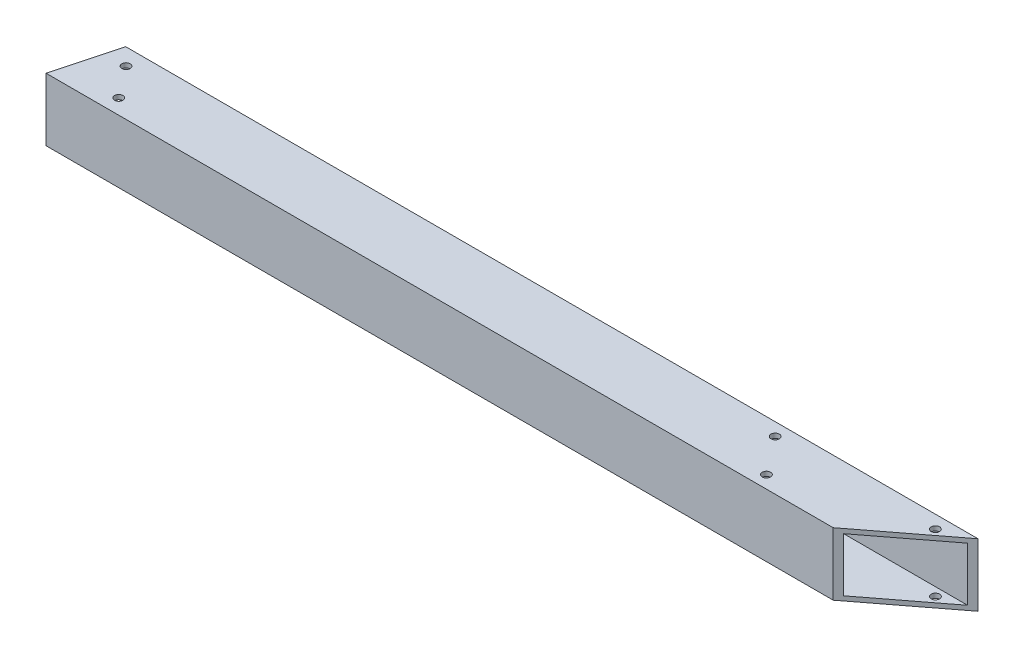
SolidWorks part; units mm, degrees
ref_plane "Front" through (0, 0, 0) normal (0, 0, 1) x (1, 0, 0)
ref_plane "Top" through (0, 0, 0) normal (0, 1, 0) x (1, 0, 0)
ref_plane "Right" through (0, 0, 0) normal (1, 0, 0) x (0, 0, -1)
sketch "Sketch1" plane through (0, 0, 0) normal (1, 0, 0) x (0, 0, -1)
  line L1 (0, 0) -> (50.8, 0)
  line L2 (0, 0) -> (0, 50.8)
  line L3 (0, 50.8) -> (50.8, 50.8)
  line L4 (50.8, 0) -> (50.8, 50.8)
  line L5 (3.6576, 47.1424) -> (47.1424, 47.1424)
  line L6 (3.6576, 47.1424) -> (3.6576, 3.6576)
  line L7 (3.6576, 3.6576) -> (47.1424, 3.6576)
  line L8 (47.1424, 47.1424) -> (47.1424, 3.6576)
  dimension "D1" = 50.8
  dimension "D2" = 50.8
  dimension "D3" = 3.6576
  dimension "D4" = 3.6576
  dimension "D5" = 3.6576
  dimension "D6" = 3.6576
extrude "Extrude1" add sketch "Sketch1" along normal blind 3048
sketch "Sketch3" plane through (0, 0, -50.8) normal (0, 0, -1) x (-1, 0, 0)
  line L5 (0, 0) -> (0, -664.0913) construction
  line L6 (0, -664.0913) -> (-3047.8384, -664.0913) construction
  line L7 (-3047.8384, 0) -> (-3047.8384, -664.0913) construction
  line L8 (-1523.9192, -664.0913) -> (-1523.9192, 171.6838) construction
  circle A0 centre (-95.6188, 12.3324) radius 3.3731
  circle A1 centre (-57.6849, 37.9799) radius 3.3731
  circle A2 centre (-3028.95, 12.7) radius 3.3731
  circle A4 centre (-19.4204, 12.8284) radius 3.3731
  circle A5 centre (-2952.2196, 12.3324) radius 3.3731
  circle A6 centre (-2990.85, 38.1) radius 3.3731
  point P0 (-3047.8384, 0)
extrude "Cut-Extrude2" [suppressed] cut sketch "Sketch3" against normal through all
sketch "Sketch4" plane through (0, 0, -50.8) normal (0, 0, -1) x (-1, 0, 0)
  circle A0 centre (-2235.1466, 25.4) radius 3.3731
  circle A1 centre (-2298.6466, 25.4) radius 3.3731
  circle A2 centre (-2362.1466, 25.4) radius 3.3731
  circle A3 centre (-812.7466, 25.4) radius 3.3731
  circle A4 centre (-749.2466, 25.4) radius 3.3731
  circle A5 centre (-685.7466, 25.4) radius 3.3731
  dimension "D1" = 6.7462
extrude "Cut-Extrude3" [suppressed] cut sketch "Sketch4" against normal through all
sketch "Sketch5" plane through (0, 0, -50.8) normal (0, 0, -1) x (-1, 0, 0)
  circle A0 centre (-1536.7, 38.1) radius 3.3731
  circle A1 centre (-1511.2466, 12.7) radius 3.3731
  dimension "D1" = 6.7462
sketch "Sketch6" plane through (0, 0, -50.8) normal (0, 0, -1) x (-1, 0, 0)
  circle A0 centre (-1524.0534, 25.4) radius 3.3731
  circle A1 centre (-1460.5534, 25.4) radius 3.3731
  circle A2 centre (-1587.5534, 25.4) radius 3.3731
  circle A3 centre (-736.6534, 12.7) radius 3.3731
  circle A4 centre (-762.0534, 38.1) radius 3.3731
  circle A5 centre (-2311.4534, 38.1) radius 3.3731
  circle A6 centre (-2286.0534, 12.7) radius 3.3731
  dimension "D1" = 6.7462
  dimension "D2" = 6.7462
  dimension "D3" = 6.7462
extrude "Cut-Extrude4" [suppressed] cut sketch "Sketch6" against normal through all
sketch "Sketch7" plane through (0, 0, -50.8) normal (0, 0, -1) x (-1, 0, 0)
  circle A0 centre (-1536.7, 38.1) radius 3.3731
  circle A1 centre (-1511.2466, 12.7) radius 3.3731
  dimension "D1" = 6.7462
  dimension "D2" = 6.7462
extrude "Cut-Extrude5" [suppressed] cut sketch "Sketch7" against normal through all
sketch "Sketch8" plane through (0, 0, 0) normal (0, 0, 1) x (1, 0, 0)
  line L0 (1524, 50.8) -> (1524, 207.5111) construction
  line L1 (3048, 50.8) -> (0, 50.8) construction
  circle A0 centre (95.25, 12.7) radius 3.304
  circle A1 centre (57.15, 38.1) radius 3.1902
  circle A2 centre (19.05, 12.7) radius 3.304
  circle A3 centre (3028.95, 12.7) radius 3.304
  circle A4 centre (2990.85, 38.1) radius 3.1902
  circle A5 centre (2952.75, 12.7) radius 3.304
extrude "Cut-Extrude6" [suppressed] cut sketch "Sketch8" against normal through all
sketch "Sketch9" plane through (0, 0, -50.8) normal (0, 0, -1) x (-1, 0, 0)
  circle A0 centre (-44.45, 38.1) radius 3.3731
  circle A1 centre (-3003.55, 12.7) radius 3.3731
  circle A2 centre (-3028.95, 38.1) radius 3.3731
  dimension "D1" = 6.7462
  dimension "D2" = 6.7462
extrude "Cut-Extrude7" [suppressed] cut sketch "Sketch9" against normal through all
sketch "Sketch10" plane through (0, 0, 0) normal (0, 0, 1) x (1, 0, 0)
  line L1 (3407.5044, 166.4746) -> (1445.514, 166.4746)
  line L2 (3407.5044, 166.4746) -> (3407.5044, -140.6406)
  line L3 (3407.5044, -140.6406) -> (1445.514, -140.6406)
  line L4 (1445.514, 166.4746) -> (1445.514, -140.6406)
  dimension "D1" = 1445.514
extrude "Extrude2" cut sketch "Sketch10" against normal through all
sketch "Sketch11" plane through (0, 0, 0) normal (0, 0, 1) x (1, 0, 0)
  line L0 (0, 0) -> (1444.7168, 50.8) construction
  line L1 (1445.514, 50.8) -> (0, 50.8) construction
  line L3 (1444.7168, 50.8) -> (1448.6138, 50.8)
  line L4 (1444.7168, 50.8) -> (1444.7168, -1.6077)
  line L5 (1444.7168, -1.6077) -> (1448.6138, -1.6077)
  line L6 (1448.6138, 50.8) -> (1448.6138, -1.6077)
  dimension "D1" = 1445.6097
extrude "Extrude3" cut sketch "Sketch11" against normal through all
sketch "Sketch12" plane through (0, 0, 0) normal (0, -1, 0) x (1, 0, 0)
  line L0 (0, 0) -> (88.9938, -68.169)
  line L1 (1444.7168, 0) -> (0, 0) construction
  line L2 (88.9938, -68.169) -> (0, -57.6525)
  line L3 (0, -57.6525) -> (0, 0)
  line L4 (1444.7168, -50.8) -> (1366.8578, 8.8399)
  line L5 (1444.7168, -50.8) -> (0, -50.8) construction
  line L6 (1444.7168, -50.8) -> (1444.7168, 0) construction
  line L7 (1366.8578, 8.8399) -> (1444.7168, 8.8399)
  line L8 (1444.7168, 8.8399) -> (1444.7168, -50.8)
extrude "Cut-Extrude8" cut sketch "Sketch12" against normal through all
sketch "Sketch13" plane through (0, 50.8, 0) normal (0, 1, 0) x (1, 0, 0)
  line L0 (736.6459, -19.1622) -> (775.759, 125.8388)
  line L1 (736.6459, -19.1622) -> (-25.4573, -19.1622)
  line L2 (-25.4573, -19.1622) -> (-25.4573, 125.8388)
  line L3 (-25.4573, 125.8388) -> (775.759, 125.8388)
extrude "Cut-Extrude9" cut sketch "Sketch13" against normal through all
sketch "Sketch14" plane through (0, 50.8, 0) normal (0, 1, 0) x (1, 0, 0)
  circle A0 centre (788.5369, 12.1017) radius 3.3731
  circle A1 centre (769.2299, 37.3068) radius 3.3731
extrude "Cut-Extrude10" cut sketch "Sketch14" against normal through all
sketch "Sketch15" plane through (0, 50.8, 0) normal (0, 1, 0) x (1, 0, 0)
  circle A0 centre (1420.7785, 40.2815) radius 3.3731
  circle A1 centre (1314.2529, 10.1759) radius 3.3731
  circle A2 centre (1291.0844, 40.422) radius 3.3731
  dimension "D1" = 6.7462
extrude "Cut-Extrude11" cut sketch "Sketch15" against normal through all
